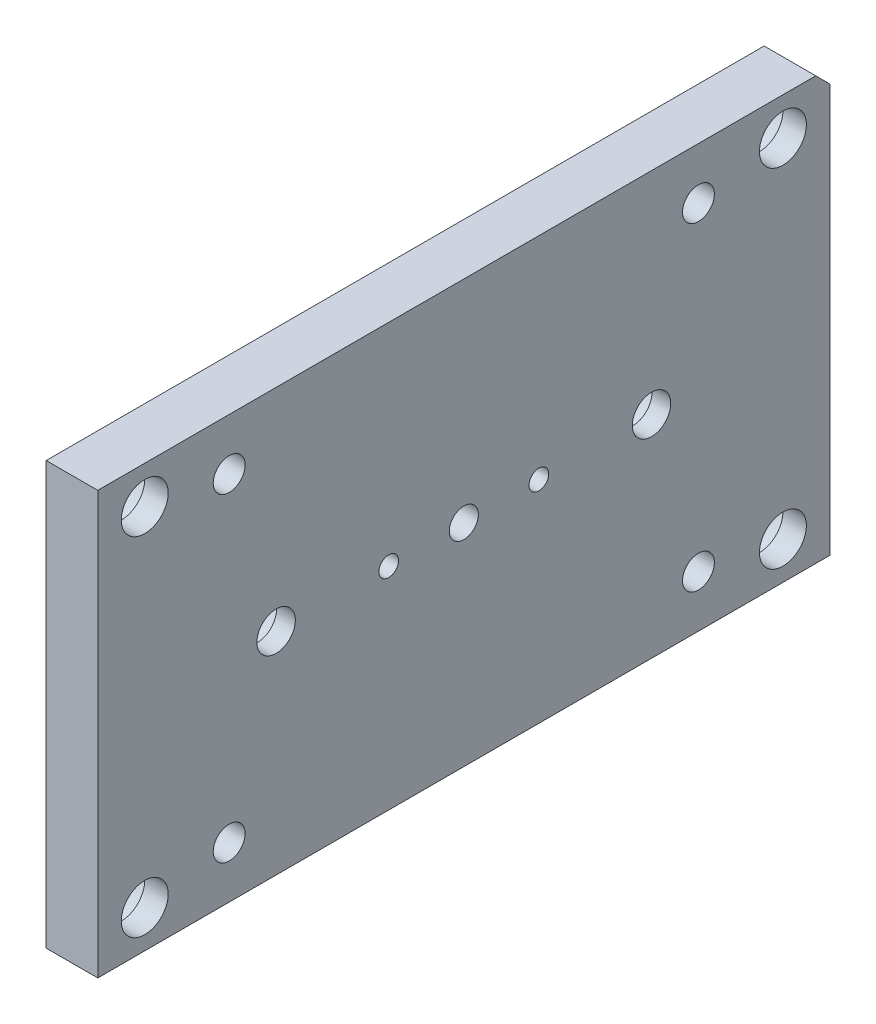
SolidWorks part; units mm, degrees
ref_plane "Plan de face" through (0, 0, 0) normal (0, 0, 1) x (1, 0, 0)
ref_plane "Plan de dessus" through (0, 0, 0) normal (0, 1, 0) x (1, 0, 0)
ref_plane "Plan de droite" through (0, 0, 0) normal (1, 0, 0) x (0, 0, -1)
sketch "Esquisse1" plane through (0, 0, 0) normal (1, 0, 0) x (0, 0, -1)
  line L1 (-78, 45) -> (78, 45)
  line L2 (-78, 45) -> (-78, -45)
  line L3 (-78, -45) -> (78, -45)
  line L4 (78, 45) -> (78, -45)
  point P4 (-78, 0)
  point P7 (0, -45)
  dimension "D1" = 156
  dimension "D2" = 90
extrude "Extrusion1" add sketch "Esquisse1" along normal blind 11
sketch "Esquisse32" plane through (0, 29.6948, -30.9346) normal (-1, 0, 0) x (0, 0, 1)
  line L1 (30.9346, 78) -> (30.9346, -78) construction
  line L6 (108.9346, -29.6948) -> (-47.0654, -29.6948) construction
  circle A0 centre (-9.0654, -29.6948) radius 4.1
  circle A1 centre (-37.0654, 7.3052) radius 5
  circle A4 centre (70.9346, -29.6948) radius 4.1
  circle A5 centre (98.9346, 7.3052) radius 5
  circle A6 centre (98.9346, -66.6948) radius 5
  circle A7 centre (-37.0654, -66.6948) radius 5
  circle A8 centre (30.9346, -29.6948) radius 3.1
  circle A9 centre (14.9346, -29.6948) radius 2.1
  circle A10 centre (46.9346, -29.6948) radius 2.1
  dimension "D3" = 10
  dimension "D4" = 68
  dimension "D5" = 6.2
  dimension "D6" = 8.2
  dimension "D7" = 16
  dimension "D11" = 40
  dimension "D12" = 37
  dimension "D17" = 4.2
  dimension "D13" = 136
  dimension "D25" = 40
  dimension "D16" = 16
  dimension "D14" = 74
extrude "Enlèv. mat.-Extru.1" cut sketch "Esquisse32" against normal through all
hole_wizard "Trou taraudé M81" positions "Esquisse34" profile "Esquisse33" tap size "M8" standard "ISO"
sketch "Esquisse34" plane through (0, 0, 0) normal (-1, 0, 0) x (0, 0, 1)
  point P0 (50, 34)
  point P1 (-50, 34)
  point P3 (-50, -34)
  point P5 (50, -34)
  dimension "D1" = 50
  dimension "D2" = 34
  dimension "D3" = 100
  dimension "D4" = 68
sketch "Esquisse33" plane through (0, 34, 50) normal (0, 1, 0) x (0, 0, 1)
  line L0 (0, 0) -> (0, 11)
  line L1 (0, 11) -> (3.4, 11)
  line L2 (3.4, 11) -> (3.4, 0)
  line L5 (3.4, 0) -> (0, 0)
  line L11 (0, -6.35) -> (0, 107.95) construction
  dimension "Diamètre du trou pour taraudage jusqu'au prochain" = 6.8
  dimension "Profondeur du trou pour taraudage jusqu'au prochain" = 11
sketch "Esquisse35" plane through (0, 0, 0) normal (-1, 0, 0) x (0, 0, 1)
  circle A0 centre (-68, 37) radius 7.5
  circle A1 centre (68, 37) radius 7.5
  circle A2 centre (68, -37) radius 7.5
  circle A3 centre (-68, -37) radius 7.5
  dimension "D1" = 15
extrude "Enlèv. mat.-Extru.2" cut sketch "Esquisse35" against normal blind 6
sketch "Esquisse37" plane through (0, 0, 0) normal (-1, 0, 0) x (0, 0, 1)
  circle A0 centre (-16, 0) radius 4.25
  circle A1 centre (16, 0) radius 4.25
  dimension "D1" = 8.5
extrude "Enlèv. mat.-Extru.4" cut sketch "Esquisse37" against normal blind 4
sketch "Esquisse38" plane through (0, 0, 0) normal (-1, 0, 0) x (0, 0, 1)
  circle A0 centre (-40, 0) radius 7.5
  circle A1 centre (40, 0) radius 7.5
  dimension "D1" = 15
  dimension "D2" = 15
extrude "Enlèv. mat.-Extru.5" cut sketch "Esquisse38" against normal blind 7
chamfer "Chanfrein_D" distance 3 angle 45 1 edges at (5.5, 45, -78)
